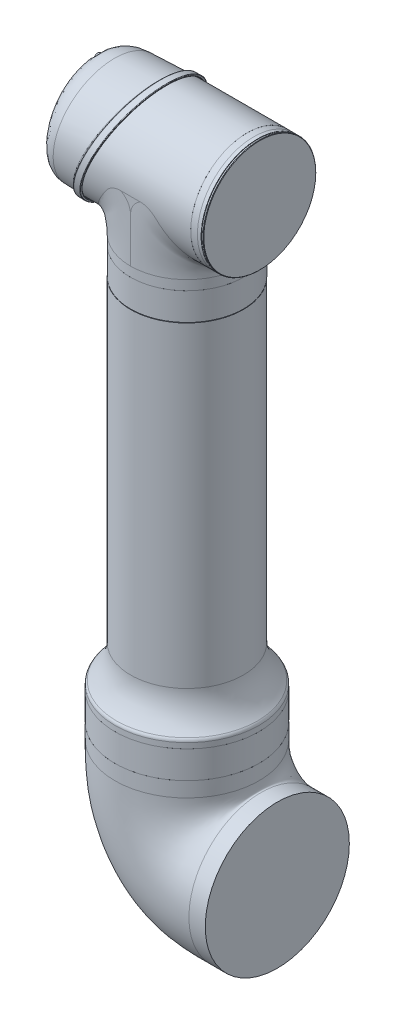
SolidWorks part; units mm, degrees
ref_plane "前视基准面" through (0, 0, 0) normal (0, 0, 1) x (1, 0, 0)
ref_plane "上视基准面" through (0, 0, 0) normal (0, 1, 0) x (1, 0, 0)
ref_plane "右视基准面" through (0, 0, 0) normal (1, 0, 0) x (0, 0, -1)
imported_body "CS66-Link2A-1-solid1"
imported_body "CS66-Link2B-1-solid1"
imported_body "CS66-Link2B-1-solid2"
imported_body "CS66-Link2B-1-solid3"
imported_body "CS66-J6-1-solid1"
imported_body "CS66-J6-1-solid2"
imported_body "CS66-J6-1-solid3"
imported_body "CS66-J6-1-solid4"
imported_body "CS66-J6-1-solid5"
imported_body "CS66-J6-1-solid6"
imported_body "CS66-J6-1-solid7"
imported_body "CS66-J6-1-solid8"
imported_body "CS66-J6-1-solid9"
imported_body "CS66-J6-1-solid10"
other "移动面1" parameters "D1"=7
